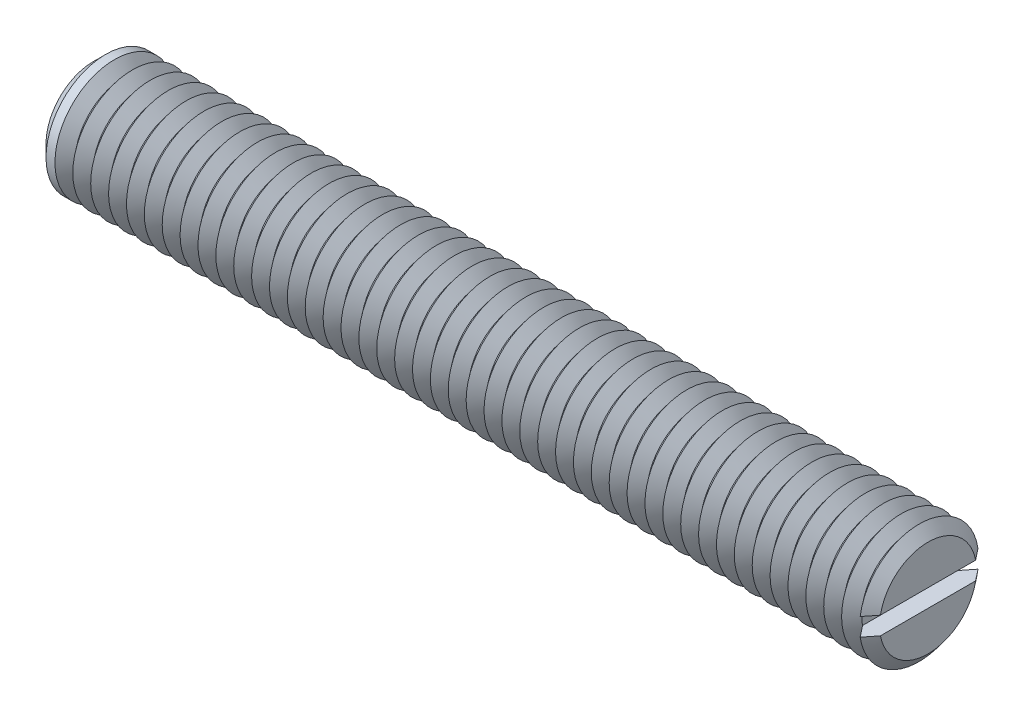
SolidWorks part; units mm, degrees
ref_plane "Front Plane" through (0, 0, 0) normal (0, 0, 1) x (1, 0, 0)
ref_plane "Top Plane" through (0, 0, 0) normal (0, 1, 0) x (1, 0, 0)
ref_plane "Right Plane" through (0, 0, 0) normal (1, 0, 0) x (0, 0, -1)
sketch "Sketch1" plane through (0, 0, 0) normal (1, 0, 0) x (0, 0, -1)
  circle A0 centre (0, 0) radius 5
  dimension "D1" = 10
extrude "Extrude1" add sketch "Sketch1" along normal mid plane 70
sketch "Sketch2" plane through (0, 0, 0) normal (0, 0, 1) x (1, 0, 0)
  line L0 (35, 0.75) -> (33.5, 0.75)
  line L1 (35, -5) -> (35, 5) construction
  line L2 (33.5, 0.75) -> (33.5, -0.75)
  line L3 (0, 0) -> (50000, 0) construction
  line L4 (35, -0.75) -> (33.5, -0.75)
  line L5 (35, -0.75) -> (35, 0.75)
  point P9 (33.5, 0)
  dimension "D1" = 1.5
extrude "Extrude2" cut sketch "Sketch2" against normal mid plane 15
chamfer "Chamfer1" distance 1 angle 45 1 edges at (-35, 0, -5)
sketch "Sketch3" plane through (0, 0, 0) normal (0, 0, 1) x (1, 0, 0)
  line L0 (0, 0) -> (30.9602, 0) construction
  line L1 (34.25, -5) -> (35.75, -5)
  line L2 (-34, -5) -> (35, -5) construction
  line L3 (35.75, -5) -> (35, -4.0633)
  line L4 (35, -5) -> (35, -0.75) construction
  line L5 (35, -4.0633) -> (34.25, -5)
  dimension "D1" = 1.5
  dimension "D2" = 1.2
revolve "Cut-Revolve1" cut sketch "Sketch3" angle 360 about L0
pattern_linear "LPattern1" count 46 spacing 1.5 along (-1, 0, 0) of "Cut-Revolve1"
equation "\"D2@Sketch3\" = \"D1@Sketch3\"*0.8"
